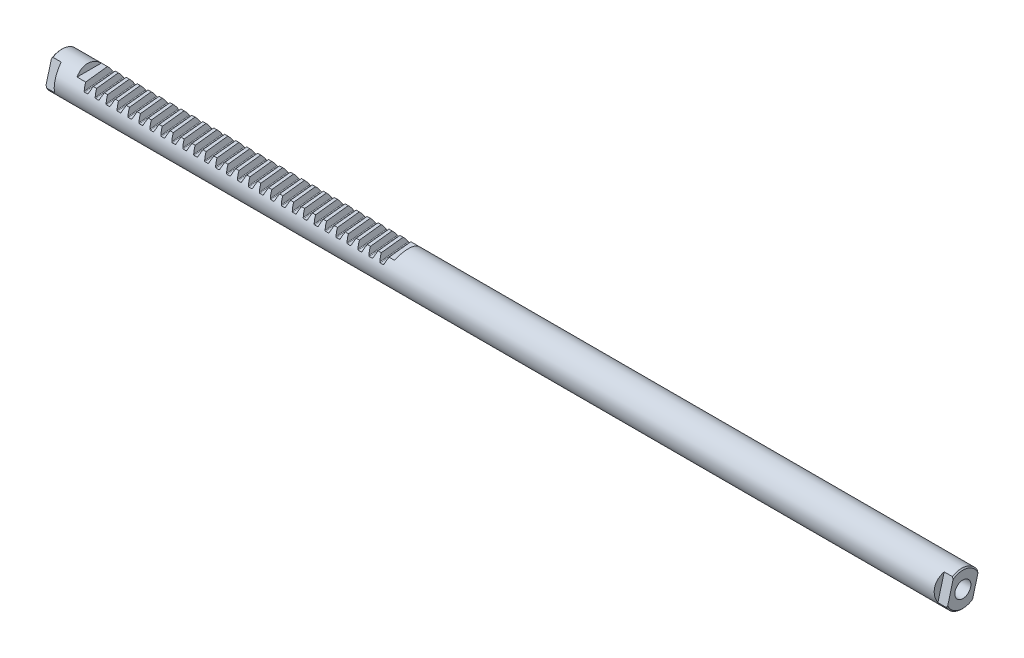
SolidWorks part; units mm, degrees
ref_plane "Plan1" through (0, 0, 0) normal (0, 0, 1) x (1, 0, 0)
ref_plane "Plan2" through (0, 0, 0) normal (0, 1, 0) x (1, 0, 0)
ref_plane "Plan3" through (0, 0, 0) normal (1, 0, 0) x (0, 0, -1)
sketch "Esquisse1" plane through (0, 0, 0) normal (0, 0, 1) x (1, 0, 0)
  line L0 (301, 0) -> (-332, 0) construction
  line L1 (-257.1132, 0) -> (257.1132, 0)
  line L2 (-280, 5) -> (-280, 10.2929)
  line L3 (-279.2929, 11) -> (279.2929, 11)
  line L4 (0, 0) -> (0, 44) construction
  line L5 (-280, 10.2929) -> (-279.2929, 11)
  line L6 (-280, 5) -> (-260, 5)
  line L7 (-260, 5) -> (-257.1132, 0)
  line L8 (260, 5) -> (257.1132, 0)
  line L9 (280, 5) -> (260, 5)
  line L10 (280, 10.2929) -> (279.2929, 11)
  line L11 (280, 5) -> (280, 10.2929)
  point P16 (0, 11)
  dimension "D1" = 1
  dimension "D2" = 45
  dimension "D3" = 11
  dimension "D4" = 280
  dimension "D5" = 5
  dimension "D6" = 60
  dimension "D7" = 20
revolve "Base-Révolution" add sketch "Esquisse1" angle 360 about L0
sketch "Esquisse2" plane through (0, 0, 0) normal (0, 0, 1) x (1, 0, 0)
  line L0 (279.2929, 11) -> (-279.2929, 11) construction
  line L1 (-262.5441, 8) -> (-65.4559, 8)
  line L2 (-264, 12) -> (-262.5441, 8)
  line L3 (-264, 12) -> (-64, 12)
  line L4 (-64, 12) -> (-65.4559, 8)
  line L5 (-280, 10.2929) -> (-280, -10.2929) construction
  dimension "D1" = 200
  dimension "D2" = 16
  dimension "D3" = 70
  dimension "D4" = 70
  dimension "D5" = 4
  dimension "D6" = 1
extrude "Enlèv. mat.-Extru.1" cut sketch "Esquisse2" against normal mid plane 25
sketch "Esquisse5" plane through (0, 0, 0) normal (0, 0, 1) x (1, 0, 0)
  line L0 (-258, 27) -> (-258, -16) construction
  line L1 (-280, 10.2929) -> (-280, -10.2929) construction
  dimension "D1" = 22
ref_plane "Plan5" through (-2.819, 0, -26.8206) normal (0.1045, 0, 0.9945) x (0.9945, 0, -0.1045)
sketch "Esquisse4" plane through (-514.5866, 0, 26.9683) normal (-0.1045, 0, -0.9945) x (-0.9945, 0, 0.1045)
  line L0 (-262.8, 8) -> (-261.6913, 4.954)
  line L1 (-259.1087, 4.954) -> (-258, 8)
  line L2 (-261.2215, 4.625) -> (-259.5785, 4.625)
  line L3 (-252.6916, 8) -> (-448.7002, 8) construction
  line L4 (-262.8, 8) -> (-258, 8)
  line L5 (-258, 27) -> (-258, -16) construction
  arc A0 (-259.5785, 4.625) -> (-259.1087, 4.954) centre (-259.5785, 5.125) ccw
  arc A1 (-261.6913, 4.954) -> (-261.2215, 4.625) centre (-261.2215, 5.125) ccw
  dimension "D1" = 70
  dimension "D3" = 0.5
  dimension "D2" = 70
  dimension "D4" = 4.8
  dimension "D5" = 3.375
extrude "Enlèv. mat.-Extru.2" cut sketch "Esquisse4" against normal mid plane 25
pattern_linear "Répétition linéaire2" count 28 spacing 6.8
ref_plane "Plan6" through (0, 0, 0) normal (0, 0.9659, -0.2588) x (-1, 0, 0)
sketch "Esquisse6" plane through (0, 0, 0) normal (0, 0.9659, -0.2588) x (-1, 0, 0)
  line L0 (0, 0) -> (0, 51) construction
  line L1 (-283, 8) -> (-274.1838, 8)
  line L2 (274.1838, 8) -> (272, 14)
  line L3 (279.2929, 11) -> (-279.2929, 11) construction
  line L4 (-283, 14) -> (-283, 8)
  line L7 (-284, 0) -> (-269, 0) construction
  line L8 (-301, 0) -> (332, 0) construction
  line L9 (-283, -14) -> (-283, -8)
  line L10 (-272, -14) -> (-283, -14)
  line L11 (274.1838, -8) -> (272, -14)
  line L12 (-283, -8) -> (-274.1838, -8)
  line L13 (283, -8) -> (274.1838, -8)
  line L14 (-274.1838, -8) -> (-272, -14)
  line L15 (272, -14) -> (283, -14)
  line L16 (283, -14) -> (283, -8)
  line L17 (283, 14) -> (283, 8)
  line L18 (272, 14) -> (283, 14)
  line L19 (-274.1838, 8) -> (-272, 14)
  line L20 (283, 8) -> (274.1838, 8)
  line L22 (-272, 14) -> (-283, 14)
  line L25 (-280, 10.2929) -> (-280, -10.2929) construction
  dimension "D1" = 3
  dimension "D2" = 8
  dimension "D3" = 70
extrude "Enlèv. mat.-Extru.3" cut sketch "Esquisse6" against normal mid plane 25
sketch "Esquisse7" plane through (0, 0, 0) normal (0, 0, 1) x (1, 0, 0)
  line L0 (280, 0) -> (-280, 0) construction
  line L1 (-127.3774, 0) -> (-127.7151, 0) construction
  line L2 (-280, 10.2929) -> (-280, 4.1852) construction
  line L4 (280, 4.1852) -> (280, 10.2929) construction
  point P8 (0, 0)
